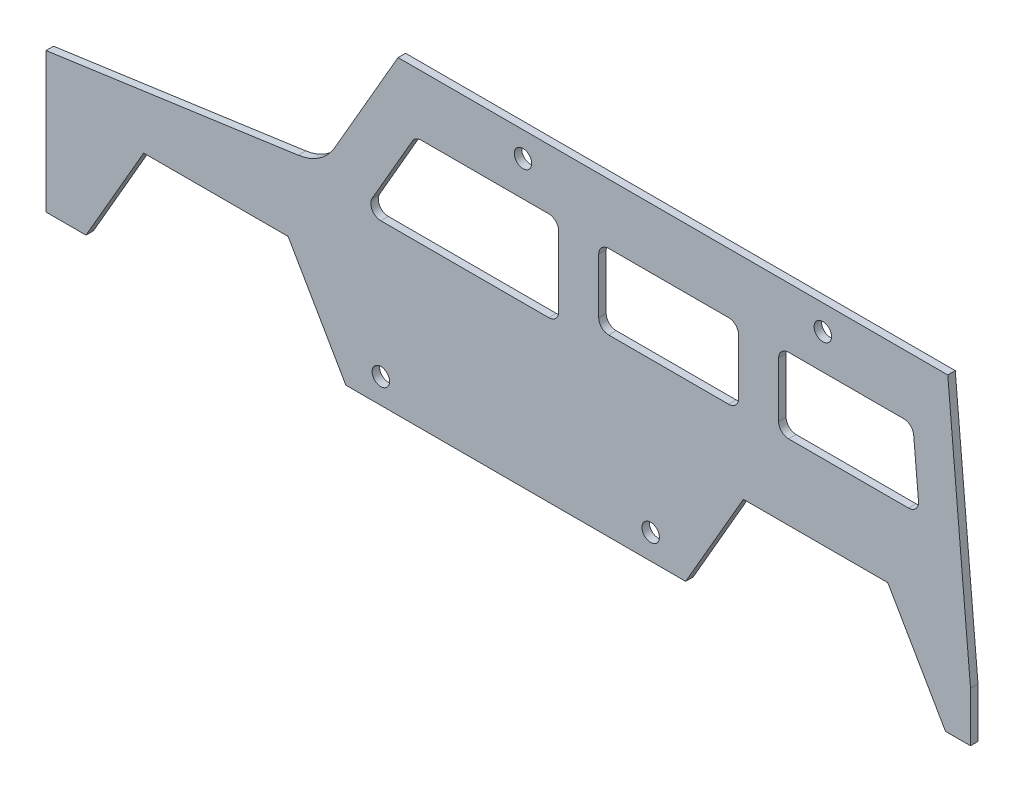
SolidWorks part; units mm, degrees
ref_plane "Front Plane" through (0, 0, 0) normal (0, 0, 1) x (1, 0, 0)
ref_plane "Top Plane" through (0, 0, 0) normal (0, 1, 0) x (1, 0, 0)
ref_plane "Right Plane" through (0, 0, 0) normal (1, 0, 0) x (0, 0, -1)
sketch "Sketch1" plane through (0, 0, 0) normal (0, 0, 1) x (1, 0, 0)
  line L0 (0, 0) -> (8, 0)
  line L1 (8, 0) -> (19.547, 20)
  line L2 (19.547, 20) -> (48.453, 20)
  line L3 (48.453, 20) -> (60, 0)
  line L4 (60, 0) -> (128, 0)
  line L5 (128, 0) -> (139.547, 20)
  line L6 (139.547, 20) -> (168.453, 20)
  line L7 (168.453, 20) -> (180, 0)
  line L8 (180, 0) -> (185, 0)
  line L9 (185, 0) -> (185, 10)
  line L10 (185, 10) -> (180.4506, 62)
  line L11 (180.4506, 62) -> (70.4506, 62)
  line L12 (70.4506, 62) -> (57.7471, 39.997)
  line L13 (50.4786, 35.0943) -> (0, 28)
  line L14 (0, 28) -> (0, 0)
  line L15 (121, 5) -> (67, 5) construction
  line L16 (95.4506, 57) -> (155.4506, 57) construction
  line L17 (155.4506, 57) -> (155.4506, 62) construction
  line L18 (95.4506, 57) -> (95.4506, 62) construction
  line L19 (75.0694, 48) -> (100.5996, 48) construction
  line L20 (112.5996, 50) -> (136.5996, 50)
  line L21 (110.5996, 48) -> (110.5996, 37)
  line L22 (112.5996, 35) -> (136.5996, 35)
  line L23 (138.5996, 48) -> (138.5996, 37)
  line L24 (75.0694, 50) -> (100.5996, 50)
  line L25 (73.3373, 49) -> (65.2544, 35)
  line L26 (66.9865, 32) -> (100.5996, 32)
  line L27 (102.5996, 48) -> (102.5996, 34)
  line L28 (148.5996, 50) -> (171.6372, 50)
  line L29 (146.5996, 48) -> (146.5996, 37)
  line L30 (148.5996, 35) -> (172.5996, 35)
  line L31 (173.6296, 48.1743) -> (174.592, 37.1743)
  line L32 (66.9865, 34) -> (100.5996, 34) construction
  line L33 (148.5996, 48) -> (136.5996, 48) construction
  line L34 (148.5996, 37) -> (136.5996, 37) construction
  circle A0 centre (121, 5) radius 1.75
  circle A1 centre (67, 5) radius 1.75
  circle A2 centre (95.4506, 57) radius 1.75
  circle A3 centre (155.4506, 57) radius 1.75
  arc A4 (50.4786, 35.0943) -> (57.7471, 39.997) centre (49.0869, 44.997) ccw
  arc A5 (173.6296, 48.1743) -> (171.6372, 50) centre (171.6372, 48) ccw
  arc A6 (172.5996, 35) -> (174.592, 37.1743) centre (172.5996, 37) ccw
  arc A7 (146.5996, 37) -> (148.5996, 35) centre (148.5996, 37) ccw
  arc A8 (148.5996, 50) -> (146.5996, 48) centre (148.5996, 48) ccw
  arc A9 (138.5996, 48) -> (136.5996, 50) centre (136.5996, 48) ccw
  arc A10 (136.5996, 35) -> (138.5996, 37) centre (136.5996, 37) ccw
  arc A11 (110.5996, 37) -> (112.5996, 35) centre (112.5996, 37) ccw
  arc A12 (112.5996, 50) -> (110.5996, 48) centre (112.5996, 48) ccw
  arc A13 (102.5996, 48) -> (100.5996, 50) centre (100.5996, 48) ccw
  arc A14 (100.5996, 32) -> (102.5996, 34) centre (100.5996, 34) ccw
  arc A15 (65.2544, 35) -> (66.9865, 32) centre (66.9865, 34) ccw
  arc A16 (75.0694, 50) -> (73.3373, 49) centre (75.0694, 48) ccw
  dimension "D7" = 3.5
  dimension "D8" = 54
  dimension "D11" = 7
  dimension "D22" = 28
  dimension "D23" = 25
  dimension "D25" = 25
  dimension "D26" = 10
  dimension "D27" = 2
  dimension "D33" = 24
  dimension "D1" = 5
  dimension "D2" = 10
  dimension "D3" = 52
  dimension "D4" = 60
  dimension "D5" = 20
  dimension "D6" = 60
  dimension "D9" = 7
  dimension "D10" = 5
  dimension "D12" = 60
  dimension "D13" = 20
  dimension "D14" = 60
  dimension "D15" = 52
  dimension "D16" = 8
  dimension "D17" = 98
  dimension "D18" = 60
  dimension "D19" = 85
  dimension "D20" = 52
  dimension "D21" = 5
  dimension "D24" = 60
  dimension "D28" = 8
  dimension "D29" = 14
  dimension "D30" = 11
  dimension "D31" = 24
  dimension "D32" = 12
  dimension "D34" = 12
  dimension "D35" = 14
  dimension "D36" = 9
sheet metal parameters "Sheet-Metal1" thickness 1.5 parameters "D1"=1
base flange "Base-Flange1" sketch "Sketch1" thickness 1.5 reverse thickness direction yes parameters "D1"=1
flat pattern "Flat-Pattern1"
sketch "Bend-Lines1" plane through (0, 0, 0) normal (0, 1, 0) x (-1, 0, 0)
